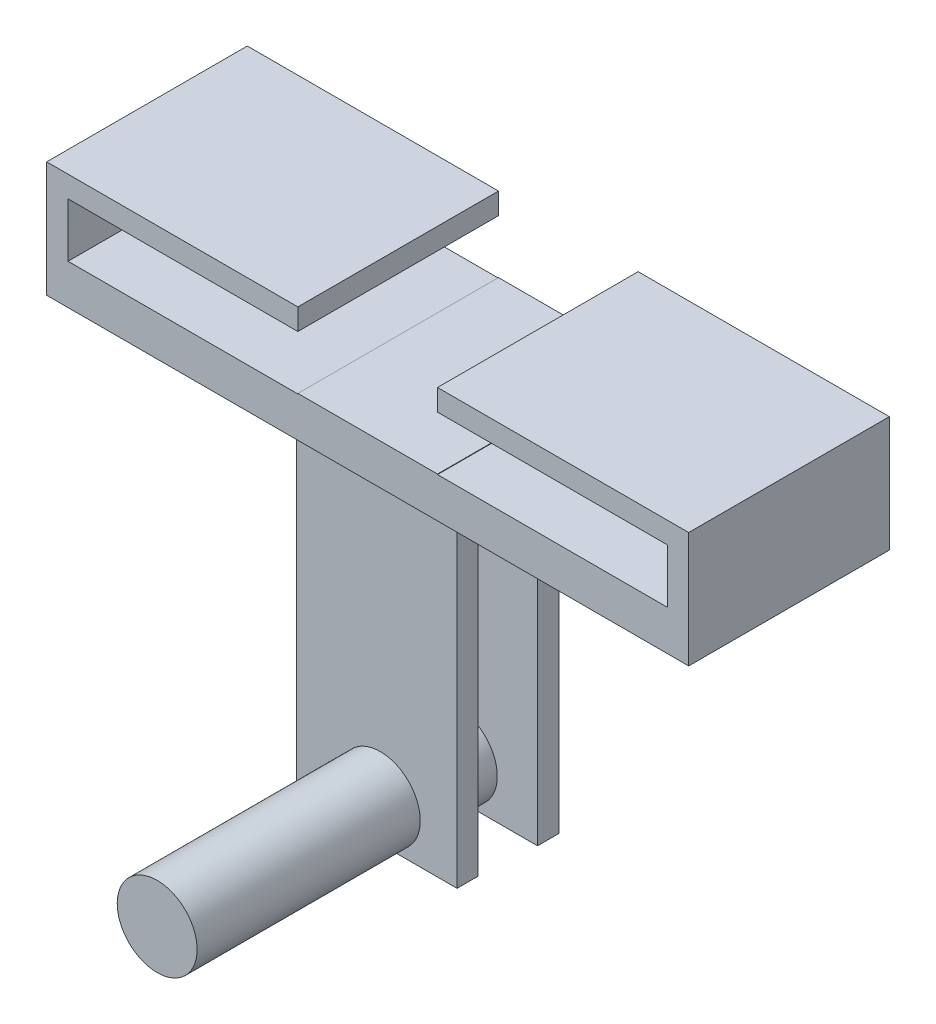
SolidWorks part; units mm, degrees
ref_plane "Front Plane" through (0, 0, 0) normal (0, 0, 1) x (1, 0, 0)
ref_plane "Top Plane" through (0, 0, 0) normal (0, 1, 0) x (1, 0, 0)
ref_plane "Right Plane" through (0, 0, 0) normal (1, 0, 0) x (0, 0, -1)
sketch "Sketch1" plane through (0, 0, 0) normal (0, 1, 0) x (1, 0, 0)
  line L1 (0, 0) -> (101.6, 0)
  line L2 (0, 0) -> (0, 31.75)
  line L3 (0, 31.75) -> (101.6, 31.75)
  line L4 (101.6, 0) -> (101.6, 31.75)
extrude "Boss-Extrude1" add sketch "Sketch1" along normal blind 18.288 contours L3 L4 L1 L2
sketch "Sketch2" plane through (0, 18.288, 0) normal (0, 1, 0) x (1, 0, 0)
  line L0 (0, 31.75) -> (101.6, 31.75) construction
  line L4 (39.751, 0) -> (39.751, 31.75)
  line L5 (0, 0) -> (101.6, 0) construction
  line L9 (61.849, 31.75) -> (61.849, 0)
  line L11 (39.751, 0) -> (61.849, 0)
  line L13 (39.751, 31.75) -> (61.849, 31.75)
extrude "Cut-Extrude1" cut sketch "Sketch2" against normal blind 11.8618
sketch "Sketch3" plane through (0, 0, 0) normal (0, 0, 1) x (1, 0, 0)
  line L0 (50.8, 6.4262) -> (50.8, 29.1234) construction
  line L5 (39.751, 6.4262) -> (61.849, 6.4262) construction
  line L6 (50.8, 29.1234) -> (50.8, -16.1656) construction
  line L7 (61.849, 14.9098) -> (98.2218, 14.9098)
  line L8 (98.2218, 6.35) -> (98.2218, 14.9098)
  line L9 (61.849, 6.35) -> (98.2218, 6.35)
  line L10 (61.849, 6.35) -> (61.849, 14.9098)
  line L11 (39.751, 6.35) -> (39.751, 14.9098)
  line L12 (39.751, 6.35) -> (3.3782, 6.35)
  line L13 (3.3782, 6.35) -> (3.3782, 14.9098)
  line L14 (39.751, 14.9098) -> (3.3782, 14.9098)
  dimension "D1" = 6.35
extrude "Cut-Extrude2" cut sketch "Sketch3" against normal through all
sketch "Sketch4" plane through (0, 0, 0) normal (0, -1, 0) x (1, 0, 0)
  line L0 (0, 0) -> (101.6, 0) construction
  line L1 (63.4898, -17.5641) -> (38.1102, -17.5641)
  line L2 (63.4898, -17.5641) -> (63.4898, -14.1859)
  line L3 (63.4898, -14.1859) -> (38.1102, -14.1859)
  line L4 (38.1102, -17.5641) -> (38.1102, -14.1859)
  line L5 (0, 0) -> (0, -31.75) construction
  point P4 (0, -15.875)
  point P5 (50.8, 0)
  point P6 (50.8, -14.1859)
  point P11 (38.1102, -15.875)
extrude "Boss-Extrude2" add sketch "Sketch4" along normal blind 50.8
sketch "Sketch5" plane through (0, 0, -14.1859) normal (0, 0, 1) x (1, 0, 0)
  line L0 (44.4754, -44.45) -> (57.1246, -44.45)
  arc A0 (57.1246, -44.45) -> (44.4754, -44.45) centre (50.8, -44.45) ccw
extrude "Boss-Extrude3" add sketch "Sketch5" along normal blind 47.498 contours L0 A0
sketch "Sketch8" plane through (0, 0, -14.1859) normal (0, 0, 1) x (1, 0, 0)
  line L0 (44.4754, -44.45) -> (57.1246, -44.45) construction
  line L1 (44.4754, -44.45) -> (57.1246, -44.45)
  arc A0 (44.4754, -44.45) -> (57.1246, -44.45) centre (50.8, -44.45) ccw
extrude "Boss-Extrude4" add sketch "Sketch8" along normal blind 47.498
sketch "Sketch10" plane through (0, 0, 0) normal (0, -1, 0) x (1, 0, 0)
  line L1 (37.5522, -5.2959) -> (62.9522, -5.2959)
  line L2 (37.5522, -5.2959) -> (37.5522, -1.9939)
  line L3 (37.5522, -1.9939) -> (62.9522, -1.9939)
  line L4 (62.9522, -5.2959) -> (62.9522, -1.9939)
extrude "Boss-Extrude5" add sketch "Sketch10" along normal up to vertex (50.8 mm away)
equation "\"a\"= 1.006"
equation "\"b\"=0.9992"
equation "\"c\"= 0.133"
equation "\"d\"= 0.050"
equation "\"e\"=0.498"
equation "\"Overall Width\"= 4"
equation "\"width\"= 1.25"
equation "\"cylindrical diameter\"= 1.50"
equation "\"c beam length\"= 4'd"
equation "\"d beam length\"= 1"
equation "\"d beam width\"= 1.25"
equation "\"D1@Sketch1\"=\"Overall Width\""
equation "\"D2@Sketch1\"=\"width\""
equation "\"depth\"= 0.720"
equation "\"D1@Boss-Extrude1\"=\"depth\""
equation "\"cut length\"= 0.87"
equation "\"D1@Sketch2\"=\"cut length\""
equation "\"D1@Sketch4\"=\"b\""
equation "\"D2@Sketch4\"=\"c\""
equation "\"D1@Sketch5\"=\"e\""
equation "\"D1@Sketch10\"=.13"
